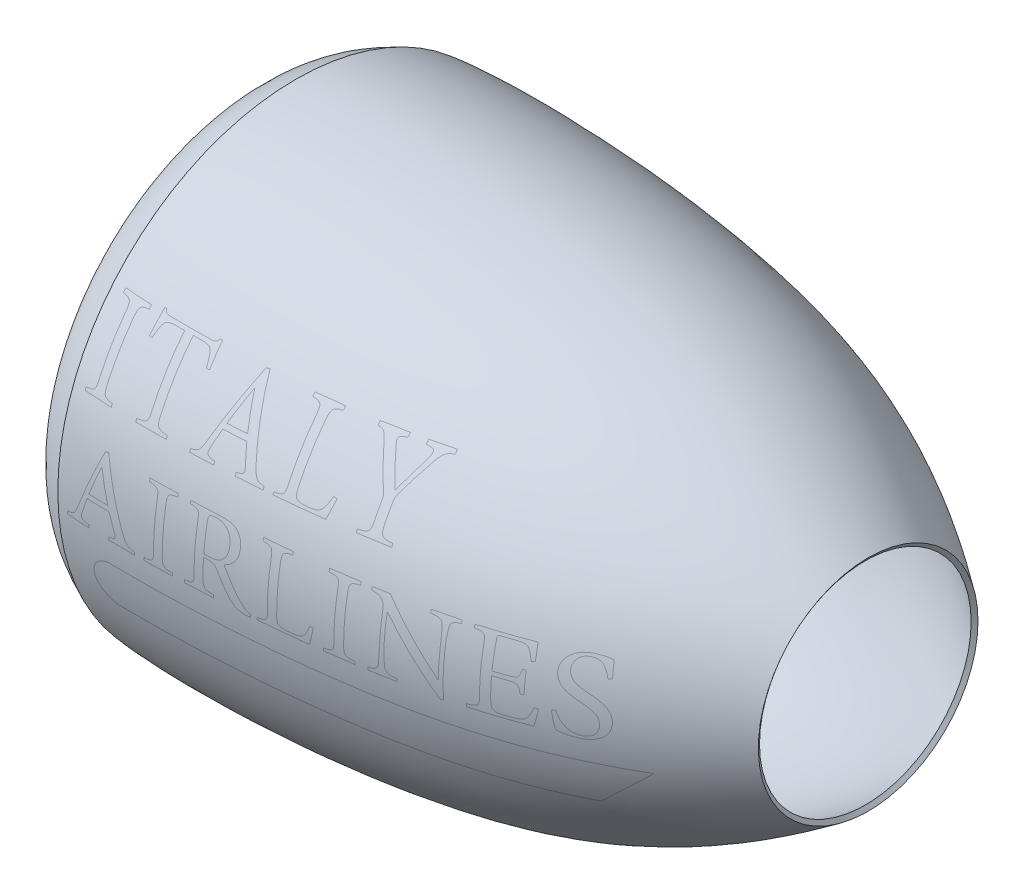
SolidWorks part; units mm, degrees
ref_plane "Front Plane" through (0, 0, 0) normal (0, 0, 1) x (1, 0, 0)
ref_plane "Top Plane" through (0, 0, 0) normal (0, 1, 0) x (1, 0, 0)
ref_plane "Right Plane" through (0, 0, 0) normal (1, 0, 0) x (0, 0, -1)
sketch "Sketch1" plane through (0, 0, 0) normal (0, 0, 1) x (1, 0, 0)
  line L0 (0, 0) -> (622.1309, 0) construction
  line L1 (0, 0) -> (0, 237.8522) construction
  line L2 (0, 180) -> (24.6868, 180)
  line L3 (24.6868, 180) -> (36.8774, 191.6492)
  line L4 (36.8774, 191.6492) -> (61.8774, 191.6492)
  spline S0 degree 3 poles (0, 237.8522) (49.7838, 244.4731) (358.6307, 242.9265) (520.9748, 150.1308) (580, 108) knots 0 0 0 0 0.611317 1 1 1 1
  spline S1 degree 2 poles (0, 237.8522) (-69.1495, 208.4031) (0, 180) knots 0 0 0 1 1 1
  point P6 (0, 0)
  point P12 (356.4243, 207.7458)
  point P13 (370.6252, 218.1528)
  point P14 (0, 251.2059)
  point P15 (-49.8476, 218.1528)
  point P16 (25.6087, 180.6761)
  point P17 (0, 0)
  point P18 (372.6414, 208.4816)
  point P19 (-40.4463, 217.9004)
  point P20 (36.8275, 191.6042)
  point P21 (66.942, 191.6492)
  point P22 (0, 237.8522)
  point P23 (-34.5734, 208.4816)
  dimension "D1" = 580
  dimension "D2" = 108
  dimension "D3" = 180
  dimension "D4" = 191.6492
  dimension "D5" = 24.6868
  dimension "D6" = 25
surface "Surface-Revolve1" sketch "Sketch1" parameters "D1"=360
thicken "Thicken1" surfaces to thicken 101 thickness 5 parameters "D1"=5
ref_plane "Plane1" through (0, 0, 250) normal (0, 0, 1) x (1, 0, 0)
sketch "Sketch2" plane through (0, 0, 250) normal (0, 0, 1) x (1, 0, 0)
  line L0 (7.1126, 87.9177) -> (696.8671, 87.9177) construction
  line L1 (7.1126, -14.3865) -> (735.1845, -14.3865) construction
  line L3 (52.9592, -58.0123) -> (493.0845, -58.0123) construction
  line L4 (52.9592, -36.8987) -> (515.4278, -36.8987)
  line L5 (52.9592, -79.126) -> (470.7411, -79.126)
  line L6 (515.4278, -36.8987) -> (470.7411, -79.126)
  arc A0 (52.9592, -36.8987) -> (52.9592, -79.126) centre (52.9592, -58.0123) ccw
  text T0 "ITALY" font "Minion Pro" height 70
  text T1 "AIRLINES" font "Minion Pro" height 70
  point P11 (251.6836, -58.0123)
